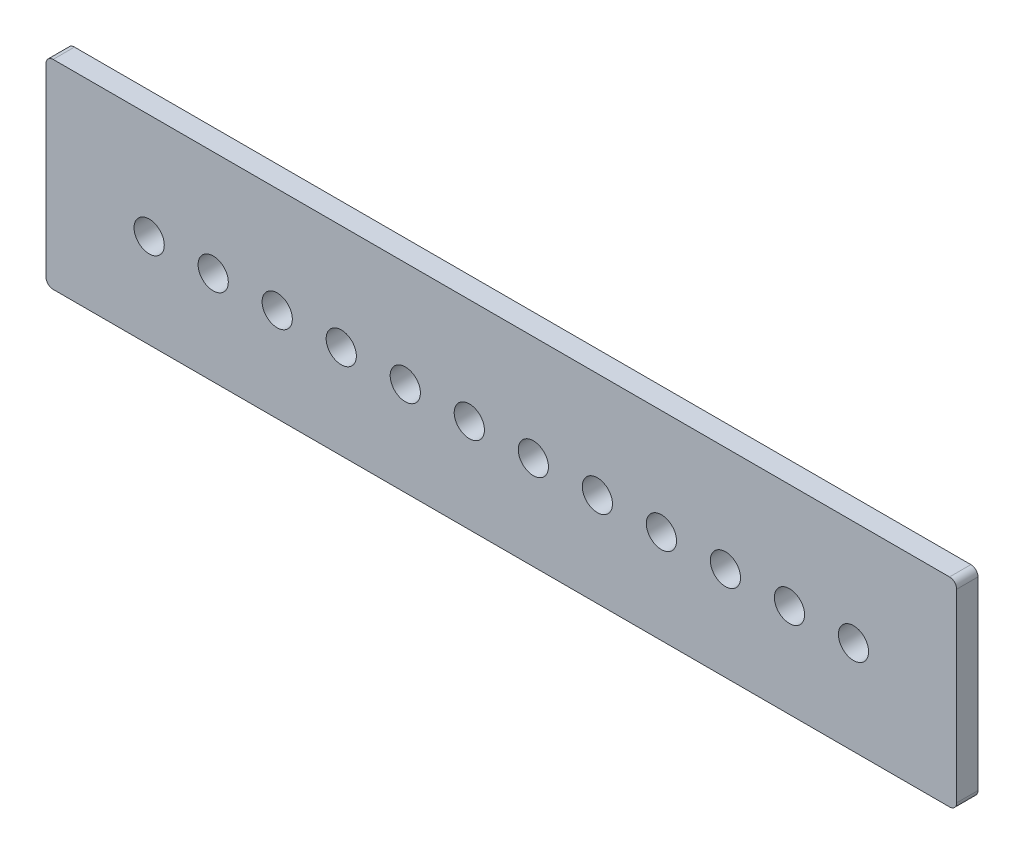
SolidWorks part; units mm, degrees
ref_plane "Front Plane" through (0, 0, 0) normal (0, 0, 1) x (1, 0, 0)
ref_plane "Top Plane" through (0, 0, 0) normal (0, 1, 0) x (1, 0, 0)
ref_plane "Right Plane" through (0, 0, 0) normal (1, 0, 0) x (0, 0, -1)
sketch "Sketch1" plane through (0, 0, 0) normal (0, 0, 1) x (1, 0, 0)
  line L1 (0, 0) -> (406.4, 0)
  line L2 (0, 0) -> (0, 88.9)
  line L3 (0, 88.9) -> (406.4, 88.9)
  line L4 (406.4, 0) -> (406.4, 88.9)
extrude "Boss-Extrude1" add sketch "Sketch1" along normal blind 9.525
sketch "Sketch2" plane through (0, 0, 9.525) normal (0, 0, 1) x (1, 0, 0)
  line L0 (406.4, 88.9) -> (0, 88.9) construction
  line L1 (0, 88.9) -> (0, 0) construction
  circle A0 centre (46.0375, 41.91) radius 6.7437
  dimension "D1" = 46.99
  dimension "D2" = 46.0375
extrude "Cut-Extrude1" cut sketch "Sketch2" against normal through all
pattern_linear "LPattern1" count 12 spacing 28.575 along (1, 0, 0) of "Cut-Extrude1"
fillet "Fillet1" radius 3.175 4 edges at (0, 0, 4.7625) (406.4, 0, 4.7625) (406.4, 88.9, 4.7625) (0, 88.9, 4.7625)
